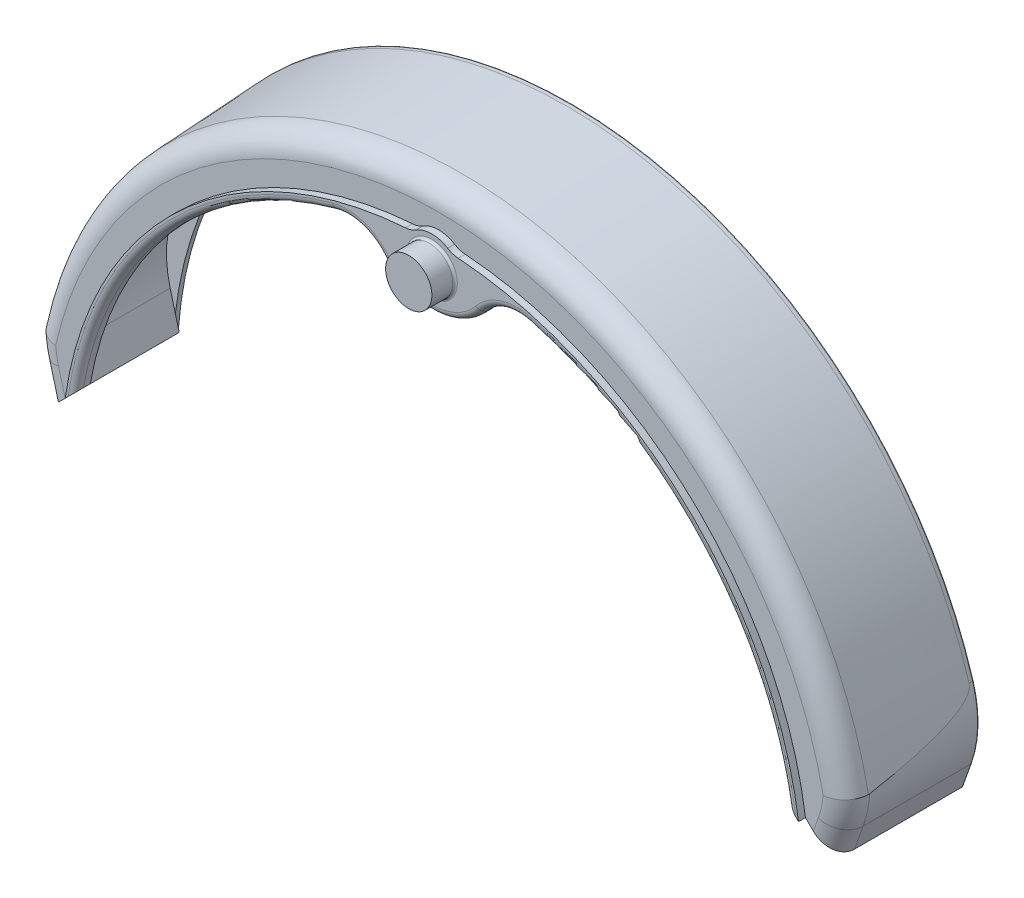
SolidWorks part; units mm, degrees
ref_plane "Plan de face" through (0, 0, 0) normal (0, 0, 1) x (1, 0, 0)
ref_plane "Plan de dessus" through (0, 0, 0) normal (0, 1, 0) x (1, 0, 0)
ref_plane "Plan de droite" through (0, 0, 0) normal (1, 0, 0) x (0, 0, -1)
sketch "Esquisse1" plane through (0, 0, 0) normal (0, 0, 1) x (1, 0, 0)
  circle A0 centre (0, 0) radius 182
  dimension "D1" = 364
extrude "Extrusion1" add sketch "Esquisse1" along normal blind 55 draft 3
sketch "Esquisse2" plane through (-11.0109, -233.403, 55) normal (0, 0, 1) x (1, 0, 0)
  line L0 (11.0109, 233.403) -> (11.0109, 482.5777) construction
  line L1 (11.0109, 233.403) -> (-270.4886, 283.039) construction
  line L2 (-142.6191, 260.4921) -> (-158.6276, 244.4836)
  line L3 (-158.6276, 244.4836) -> (-162.9865, 260.7513)
  line L4 (164.6409, 260.4921) -> (180.6494, 244.4836)
  line L5 (180.6494, 244.4836) -> (184.3947, 254.9719)
  arc A0 (-10.279, 376.9964) -> (32.3008, 376.9964) centre (11.0109, 394.403) ccw
  arc A1 (164.6409, 260.4921) -> (53.1922, 383.592) centre (11.0109, 233.403) ccw
  circle A2 centre (11.0109, 233.403) radius 182 construction
  arc A3 (185.1463, 286.3261) -> (-162.3043, 288.9534) centre (11.0109, 233.403) ccw
  arc A4 (-31.1704, 383.592) -> (-142.6191, 260.4921) centre (11.0109, 233.403) ccw
  arc A5 (-31.1704, 383.592) -> (-10.279, 376.9964) centre (-25.7625, 364.337) cw
  arc A6 (32.3008, 376.9964) -> (53.1922, 383.592) centre (47.7843, 364.337) cw
  arc A7 (-162.3043, 288.9534) -> (-162.9865, 260.7513) centre (-114.6902, 273.6923) ccw
  arc A8 (185.1463, 286.3261) -> (184.3947, 254.9719) centre (137.3069, 271.7868) cw
  point P18 (-15.5105, 387.132)
  dimension "D1" = 55
  dimension "D3" = 312
  dimension "D7" = 20
  dimension "D8" = 50
  dimension "D2" = 161
  dimension "D4" = 80
  dimension "D5" = 170
  dimension "D6" = 60
  dimension "D9" = 115
extrude "Enlèv. mat.-Extru.1" cut sketch "Esquisse2" against normal through all flip side to cut
shell "Coque1" thickness 3
fillet "Congé1" radius 10 5 edges at (175.0484, 27.284, 55) (-174.9313, 31.5491, 55) (171.5112, 16.3248, 55) (-171.818, 19.2145, 55) (1.3544, 179.1125, 55)
sketch "Esquisse3" plane through (0, 0, 0) normal (0, 0, -1) x (-1, 0, 0)
  line L8 (169.6385, 11.0806) -> (173.9974, 27.3483)
  line L9 (153.63, 27.0891) -> (169.6385, 11.0806)
  line L10 (-169.6385, 11.0806) -> (-153.63, 27.0891)
  line L11 (-173.3838, 21.5689) -> (-169.6385, 11.0806)
  line L12 (169.6385, 11.0806) -> (173.9974, 27.3483)
  line L15 (-173.3838, 21.5689) -> (-169.6385, 11.0806)
  arc A5 (169.6385, 11.0806) -> (-169.6385, 11.0806) centre (0, 0) ccw
  arc A18 (153.63, 27.0891) -> (42.1813, 150.189) centre (0, 0) ccw
  arc A19 (42.1813, 150.189) -> (21.2899, 143.5934) centre (36.7734, 130.934) ccw
  arc A20 (-21.2899, 143.5934) -> (21.2899, 143.5934) centre (0, 161) ccw
  arc A21 (-21.2899, 143.5934) -> (-42.1813, 150.189) centre (-36.7734, 130.934) ccw
  arc A22 (-42.1813, 150.189) -> (-153.63, 27.0891) centre (0, 0) ccw
  arc A23 (-174.1354, 52.9231) -> (-173.3838, 21.5689) centre (-126.296, 38.3838) ccw
  arc A24 (173.3152, 55.5504) -> (-174.1354, 52.9231) centre (0, 0) ccw
  arc A25 (173.9974, 27.3483) -> (173.3152, 55.5504) centre (125.7011, 40.2893) ccw
  arc A31 (-174.1354, 52.9231) -> (-173.3838, 21.5689) centre (-126.296, 38.3838) ccw
  arc A32 (173.3152, 55.5504) -> (-174.1354, 52.9231) centre (0, 0) ccw
  arc A33 (173.9974, 27.3483) -> (173.3152, 55.5504) centre (125.7011, 40.2893) ccw
  dimension "D1" = 0
extrude "Extrusion2" add sketch "Esquisse3" along normal blind 2
fillet "Congé2" radius 0.5 5 edges at (-171.818, 19.2145, -2) (-175.6865, 41.4985, -2) (171.5112, 16.3248, -2) (176.2817, 37.1855, -2) (1.3762, 181.9948, -2)
sketch "Esquisse5" plane through (0, 0, 55) normal (0, 0, 1) x (1, 0, 0)
  line L0 (0, 0) -> (0, 218.7167) construction
  line L1 (-153.63, 27.0891) -> (-158.4415, 22.2776)
  line L2 (153.63, 27.0891) -> (158.4415, 22.2776)
  line L3 (-161.4735, 19.2456) -> (-153.63, 27.0891) construction
  arc A0 (153.63, 27.0891) -> (42.1813, 150.189) centre (0, 0) ccw construction
  arc A1 (42.1813, 150.189) -> (21.2899, 143.5934) centre (36.7734, 130.934) ccw construction
  arc A2 (-21.2899, 143.5934) -> (21.2899, 143.5934) centre (0, 161) ccw construction
  arc A3 (-21.2899, 143.5934) -> (-42.1813, 150.189) centre (-36.7734, 130.934) ccw construction
  arc A4 (-42.1813, 150.189) -> (-153.63, 27.0891) centre (0, 0) ccw construction
  arc A5 (153.63, 27.0891) -> (42.1813, 150.189) centre (0, 0) ccw
  arc A6 (42.1813, 150.189) -> (21.2899, 143.5934) centre (36.7734, 130.934) ccw
  arc A7 (-21.2899, 143.5934) -> (21.2899, 143.5934) centre (0, 161) ccw
  arc A8 (-21.2899, 143.5934) -> (-42.1813, 150.189) centre (-36.7734, 130.934) ccw
  arc A9 (-42.1813, 150.189) -> (-153.63, 27.0891) centre (0, 0) ccw
  arc A10 (6.8299, 161.0613) -> (-6.8299, 161.0613) centre (0, 150) ccw
  arc A11 (158.4415, 22.2776) -> (11.3729, 159.5953) centre (0, 0) ccw
  arc A12 (-11.3729, 159.5953) -> (-158.4415, 22.2776) centre (0, 0) ccw
  arc A13 (-6.8299, 161.0613) -> (-11.3729, 159.5953) centre (-12.0837, 169.57) cw
  arc A14 (11.3729, 159.5953) -> (6.8299, 161.0613) centre (12.0837, 169.57) cw
  point P20 (-8.576, 159.77)
  dimension "D1" = 26
  dimension "D3" = 320
  dimension "D4" = 10
  dimension "D2" = 150
extrude "Extrusion3" add sketch "Esquisse5" along normal blind 3
fillet "Congé3" radius 3 5 edges at (115.6456, 104.7, 58) (30.7522, 150.0061, 58) (-115.6456, 104.7, 58) (-30.7522, 150.0061, 58) (0, 133.5, 58)
sketch "Esquisse6" plane through (0, 0, 58) normal (0, 0, 1) x (1, 0, 0)
  circle A0 centre (0, 150) radius 10
  dimension "D1" = 20
extrude "Extrusion4" add sketch "Esquisse6" along normal blind 10
fillet "Congé4" radius 1 1 edges at (10, 150, 58)
